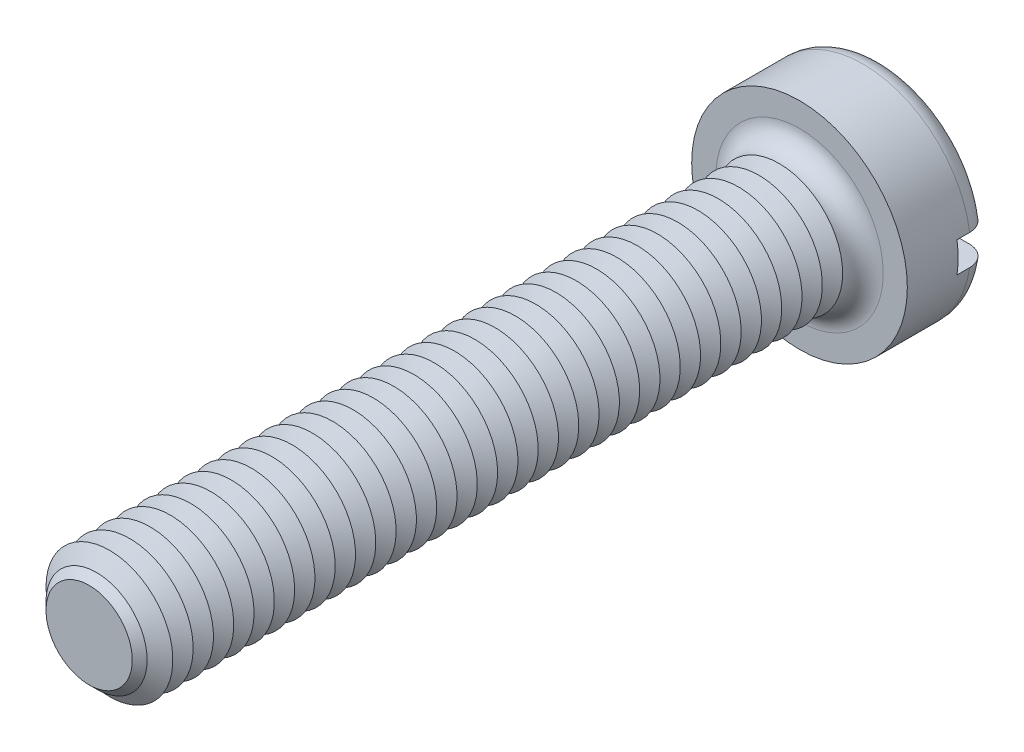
SolidWorks part; units mm, degrees
ref_plane "Front Plane" through (0, 0, 0) normal (0, 0, 1) x (1, 0, 0)
ref_plane "Top Plane" through (0, 0, 0) normal (0, 1, 0) x (1, 0, 0)
ref_plane "Right Plane" through (0, 0, 0) normal (1, 0, 0) x (0, 0, -1)
sketch "Sketch3" plane through (0, 0, 0) normal (0, 0, 1) x (1, 0, 0)
  circle A0 centre (0, 0) radius 4.25
  dimension "D1" = 8.5
extrude "Boss-Extrude2" add sketch "Sketch3" against normal blind 3.3
sketch "Sketch4" plane through (0, 0, 0) normal (0, 0, 1) x (1, 0, 0)
  circle A0 centre (0, 0) radius 2.5
  dimension "D1" = 5
extrude "Boss-Extrude3" add sketch "Sketch4" along normal blind 28
fillet "Fillet1" radius 0.8 2 edges at (4.25, 0, -3.3) (2.5, 0, 0)
chamfer "Chamfer1" distance 0.8 angle 45 1 edges at (2.5, 0, 28)
sketch "Sketch5" plane through (0, 0, 0) normal (1, 0, 0) x (0, 0, -1)
  line L0 (1.6944, 0) -> (-7.6738, 0) construction
sketch "Sketch6" plane through (0, 0, 0) normal (1, 0, 0) x (0, 0, -1)
  line L0 (-0.8, 2.5) -> (-1.2, 1.8072)
  line L1 (-1.2, 1.8072) -> (-1.6, 2.5)
  line L2 (-0.8, 2.5) -> (-27.2, 2.5) construction
  line L3 (-1.6, 2.5) -> (-0.8, 2.5)
  dimension "D1" = 0.8
revolve "Cut-Revolve1" cut sketch "Sketch6" angle 360 about L0
pattern_linear "LPattern1" count 34 spacing 0.8 along (0, 0, 1) of "Cut-Revolve1"
sketch "Sketch8" plane through (0, 0, -3.3) normal (0, 0, -1) x (-1, 0, 0)
  line L1 (4.25, -0.6) -> (-4.25, -0.6)
  line L2 (4.25, -0.6) -> (4.25, 0.6)
  line L3 (4.25, 0.6) -> (-4.25, 0.6)
  line L4 (-4.25, -0.6) -> (-4.25, 0.6)
  line L5 (4.25, -0.6) -> (-4.25, 0.6) construction
  line L6 (4.25, 0.6) -> (-4.25, -0.6) construction
  point P0 (0, 0)
  dimension "D1" = 8.5
  dimension "D2" = 1.2
extrude "Cut-Extrude1" cut sketch "Sketch8" against normal blind 1.3
